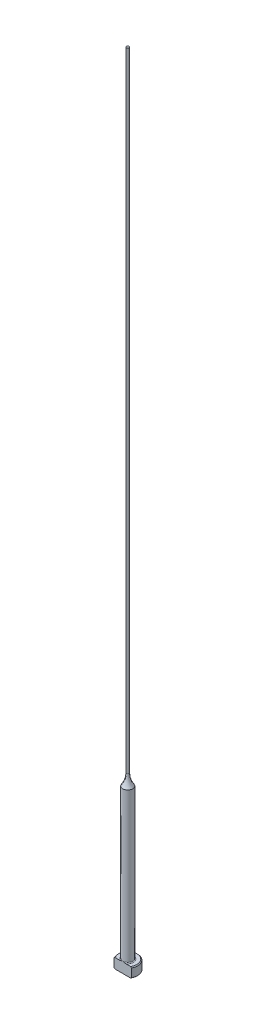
SolidWorks part; units mm, degrees
ref_plane "Front Plane" through (0, 0, 0) normal (0, 0, 1) x (1, 0, 0)
ref_plane "Top Plane" through (0, 0, 0) normal (0, 1, 0) x (1, 0, 0)
ref_plane "Right Plane" through (0, 0, 0) normal (1, 0, 0) x (0, 0, -1)
sketch "Sketch1" plane through (0, 0, 0) normal (0, 0, 1) x (1, 0, 0)
  line L0 (0, 259.9588) -> (0, -15.1925) construction
  line L1 (0, 0) -> (-3.175, 0)
  line L2 (-3.175, 0) -> (-3.175, 3.175)
  line L3 (-3.175, 3.175) -> (-1.5875, 3.175)
  line L4 (-0.3962, 54.5027) -> (-0.3962, 254)
  line L5 (-0.3962, 254) -> (0, 254)
  line L6 (0, 254) -> (0, 0)
  line L7 (-1.5875, 3.175) -> (-1.5875, 50.8)
  arc A0 (-1.5875, 50.8) -> (-0.3962, 54.5027) centre (-6.7462, 54.5027) ccw
  point P13 (-1.5875, 0)
  dimension "D1" = 6.35
  dimension "L" = 254
  dimension "D2" = 3.175
  dimension "H" = 6.35
  dimension "T" = 3.175
  dimension "D" = 0.7925
  dimension "S" = 50.8
revolve "Revolve1" add sketch "Sketch1" angle 360 about L0
chamfer "Chamfer1" distance 0.254 angle 45 2 edges at (0, 3.175, 3.175) (0, 0, 3.175)
fillet "Fillet1" radius 0.254 1 edges at (0, 3.175, 1.5875)
sketch "Sketch2" plane through (0, 0, 0) normal (0, -1, 0) x (1, 0, 0)
  line L0 (-2.7496, 1.5875) -> (2.7496, 1.5875)
  circle A0 centre (0, 0) radius 3.175 construction
  arc A1 (2.7496, 1.5875) -> (-2.7496, 1.5875) centre (0, 0) ccw
  circle A4 centre (0, 0) radius 1.5875 construction
  dimension "D1" = 0
extrude "KEY" cut sketch "Sketch2" against normal through all
